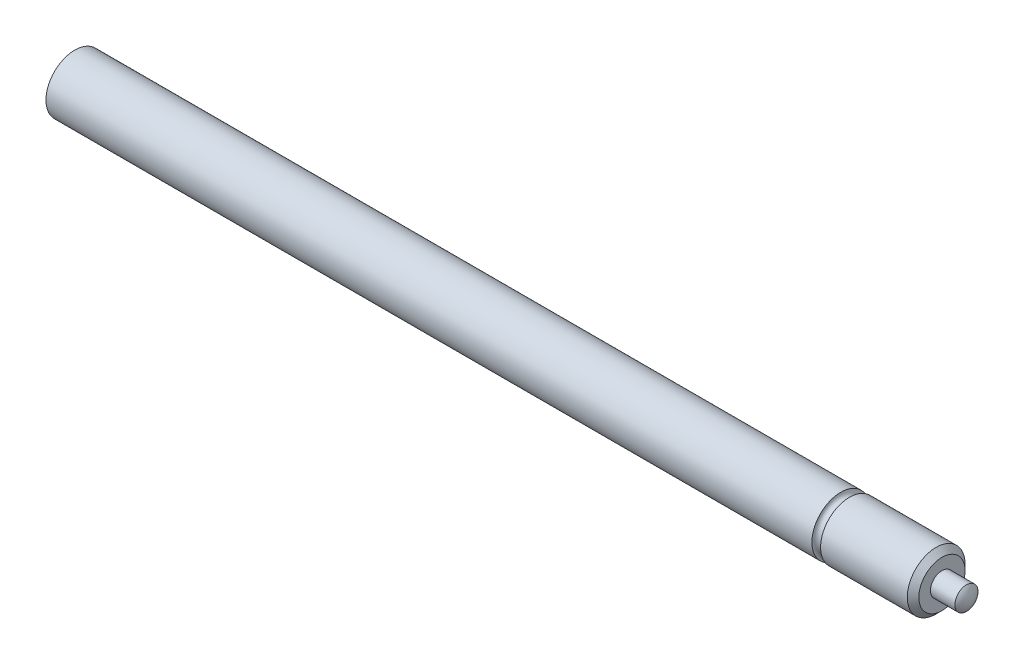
SolidWorks part; units mm, degrees
ref_plane "Plan de face" through (0, 0, 0) normal (0, 0, 1) x (1, 0, 0)
ref_plane "Plan de dessus" through (0, 0, 0) normal (0, 1, 0) x (1, 0, 0)
ref_plane "Plan de droite" through (0, 0, 0) normal (1, 0, 0) x (0, 0, -1)
sketch "Esquisse1" plane through (0, 0, 0) normal (1, 0, 0) x (0, 0, -1)
  circle A0 centre (0, 0) radius 5
  dimension "D1" = 10
extrude "Boss.-Extru.1" add sketch "Esquisse1" along normal blind 150
chamfer "Chanfrein1" distance 1 angle 45 1 edges at (150, 0, -5)
sketch "Esquisse2" plane through (0, 0, 0) normal (0, 0, 1) x (1, 0, 0)
  line L0 (149, 5) -> (0, 5) construction
  line L1 (132.5, 5) -> (134, 5)
  line L2 (150, -4) -> (150, 4) construction
  line L3 (152.0956, 0) -> (121.0803, 0) construction
  arc A0 (134, 5) -> (132.5, 5) centre (133.25, 5) cw
  dimension "D2" = 0.75
  dimension "D1" = 16.75
revolve "Enlèvement de matière-Révolution1" cut sketch "Esquisse2" angle 360 about L3
sketch "Esquisse3" plane through (150, 0, 0) normal (1, 0, 0) x (0, 0, -1)
  circle A0 centre (0, 0) radius 2
  dimension "D1" = 4
extrude "Boss.-Extru.2" add sketch "Esquisse3" along normal blind 5
sketch "Esquisse4" plane through (0, 0, 0) normal (0, 0, 1) x (1, 0, 0)
  line L0 (158.0894, 0) -> (143.8342, 0) construction
  line L1 (155, 2) -> (150, 2) construction
  line L2 (155, -2) -> (155, 2) construction
  line L3 (154.2361, 2) -> (154.2361, 3)
  line L4 (154.2361, 3) -> (156.2361, 3)
  line L5 (156.2361, 3) -> (156.2361, 0)
  line L6 (156.2361, 0) -> (155, 0)
  arc A0 (155, 0) -> (154.2361, 2) centre (152, 0) ccw
  dimension "D1" = 3
  dimension "D2" = 2
  dimension "D3" = 6
revolve "Enlèvement de matière-Révolution2" cut sketch "Esquisse4" angle 360 about L0
